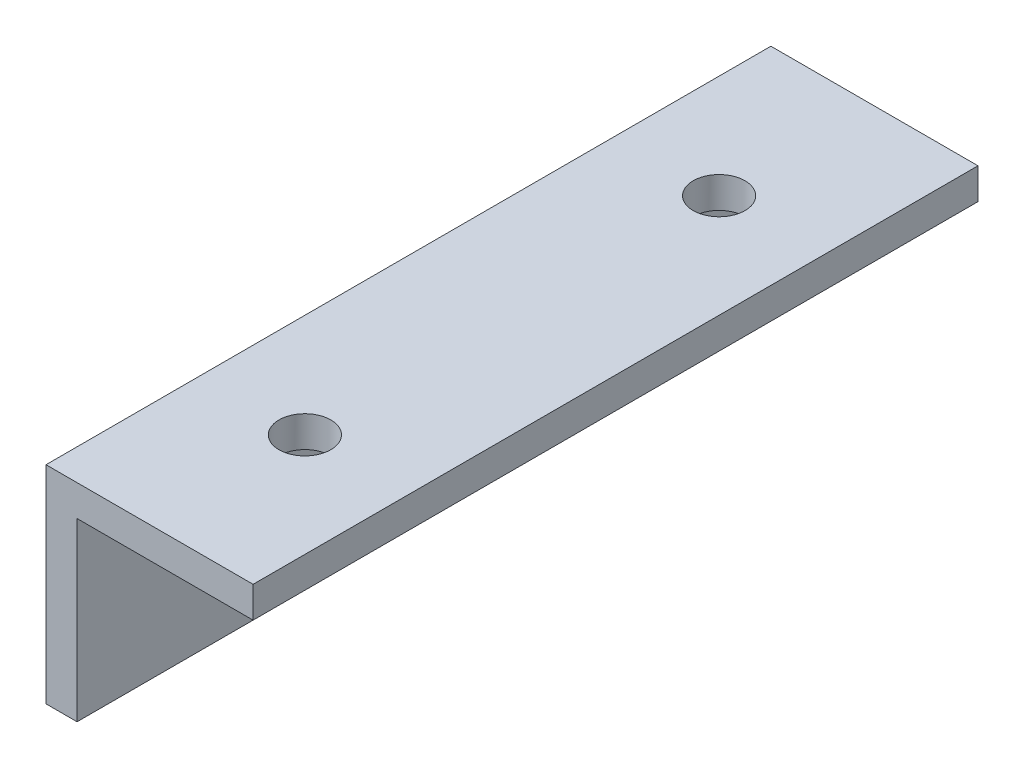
SolidWorks part; units mm, degrees
ref_plane "Front Plane" through (0, 0, 0) normal (0, 0, 1) x (1, 0, 0)
ref_plane "Top Plane" through (0, 0, 0) normal (0, 1, 0) x (1, 0, 0)
ref_plane "Right Plane" through (0, 0, 0) normal (1, 0, 0) x (0, 0, -1)
sketch "Sketch1" plane through (0, 0, 0) normal (0, 0, 1) x (1, 0, 0)
  line L0 (0, 0) -> (3, 0)
  line L1 (0, 0) -> (0, 20)
  line L2 (0, 20) -> (20, 20)
  line L3 (3, 17) -> (3, 0)
  line L6 (20, 20) -> (20, 17)
  line L7 (20, 17) -> (3, 17)
  dimension "D1" = 20
  dimension "D2" = 20
  dimension "D3" = 3
  dimension "D4" = 3
extrude "Extrude1" add sketch "Sketch1" along normal blind 70
sketch "Sketch2" plane through (0, 20, 0) normal (0, 1, 0) x (1, 0, 0)
  line L0 (10, 0) -> (10, -70) construction
  line L1 (20, 0) -> (0, 0) construction
  line L2 (20, -70) -> (0, -70) construction
  point P6 (10, -55)
  point P7 (10, -15)
  dimension "D1" = 15
  dimension "D2" = 15
hole_wizard "M6 Tapped Hole1" positions "3DSketch1" profile "Sketch3" tap size "M6" standard "ISO"
sketch3d "3DSketch1"
  point P0 (10, 20, 15)
  point P3 (10, 20, 55)
sketch "Sketch3" plane through (10, 20, 15) normal (1, 0, 0) x (0, 0, 1)
  line L0 (0, 0) -> (0, 20)
  line L1 (0, 20) -> (2.5, 20)
  line L2 (2.5, 20) -> (2.5, 0)
  line L5 (2.5, 0) -> (0, 0)
  line L11 (0, -6.35) -> (0, 107.95) construction
  dimension "Thru Tap Drill Dia." = 5
  dimension "Thru Tap Drill Depth" = 20
